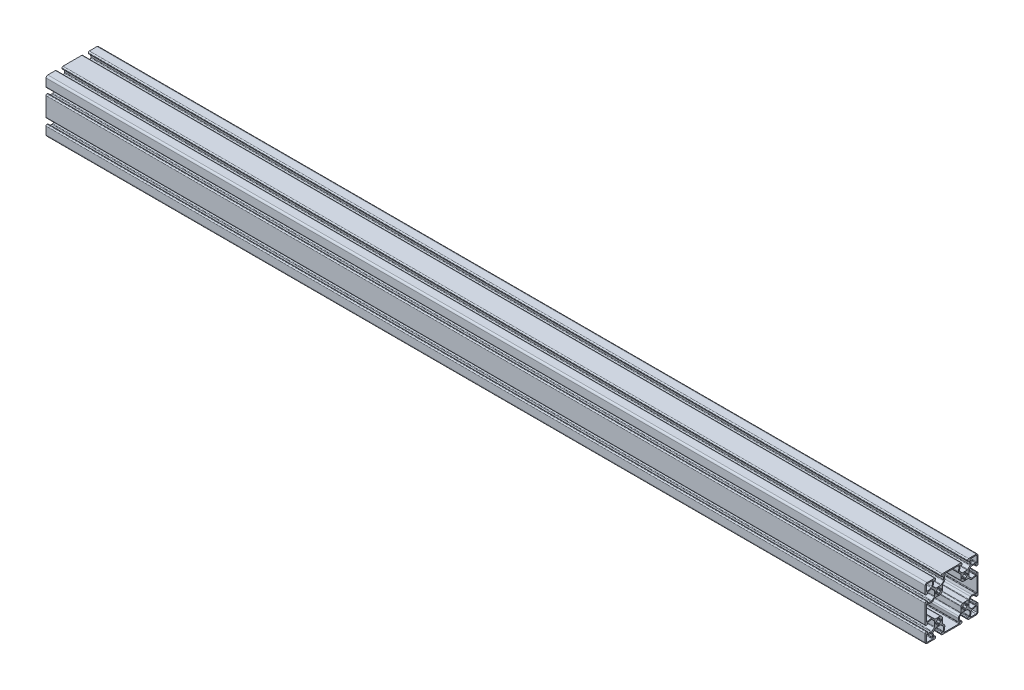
SolidWorks part; units mm, degrees
ref_plane "正面" through (0, 0, 0) normal (0, 0, 1) x (1, 0, 0)
ref_plane "平面" through (0, 0, 0) normal (0, 1, 0) x (1, 0, 0)
ref_plane "右側面" through (0, 0, 0) normal (1, 0, 0) x (0, 0, -1)
sketch "ｽｹｯﾁ1" plane through (0, 0, 0) normal (1, 0, 0) x (0, 0, -1)
  line L0 (-13.8, 23.3503) -> (-13.8, 6.6497)
  line L1 (-15, 25.65) -> (-15, 4.35)
  line L2 (43.8, 23.3503) -> (43.8, 6.6497)
  line L3 (45, 25.65) -> (45, 4.35)
  line L4 (23.3503, -13.8) -> (6.6497, -13.8)
  line L5 (25.65, -15) -> (4.35, -15)
  line L6 (-13.8, -12.8) -> (-13.8, -6.6497)
  line L7 (-15, -13) -> (-15, -4.35)
  line L8 (-6.0721, -8.0894) -> (-5.3672, -12.0868)
  line L9 (-7.2888, -8.0999) -> (-6.549, -12.2952)
  line L10 (6.0721, -8.0894) -> (5.3672, -12.0868)
  line L11 (7.2539, -8.2977) -> (6.549, -12.2952)
  line L12 (-13, -15) -> (-4.35, -15)
  line L13 (-12.8, -13.8) -> (-6.6497, -13.8)
  line L14 (-3.9, -12.5) -> (-4.8748, -12.5)
  line L15 (3.9, -12.5) -> (4.8748, -12.5)
  line L16 (3.15, -13.8) -> (3.15, -13.25)
  line L17 (-3.15, -13.8) -> (-3.15, -13.25)
  line L18 (2.0858, 4.5) -> (-3.8029, 4.5)
  line L19 (-3.3787, -4.7929) -> (-5.7944, -7.2086)
  line L20 (-4.5, -2.6716) -> (-4.5, 2.6716)
  line L21 (-8.0999, -7.2888) -> (-12.2952, -6.549)
  line L22 (-8.0894, -6.0721) -> (-12.0868, -5.3672)
  line L23 (-12.5, -4.8748) -> (-12.5, -3.9)
  line L24 (-13.25, -3.15) -> (-13.8, -3.15)
  line L25 (-4.7929, -3.3787) -> (-7.2086, -5.7944)
  line L26 (-8.2977, 7.2539) -> (-12.2952, 6.549)
  line L27 (-8.0894, 6.0721) -> (-12.0868, 5.3672)
  line L28 (-12.5, 4.8748) -> (-12.5, 3.9)
  line L29 (-13.25, 3.15) -> (-13.8, 3.15)
  line L30 (-4.5101, 4.7929) -> (-6.3601, 6.6429)
  line L31 (-4.7929, 3.3787) -> (-7.2086, 5.7944)
  line L32 (4.5, -3.8029) -> (4.5, 2.0858)
  line L33 (3.5, -0.5) -> (3.5, 0.5)
  line L34 (-3.5, -0.5) -> (-3.5, 0.5)
  line L35 (3.3787, -4.7929) -> (5.7944, -7.2086)
  line L36 (2.6557, -1) -> (3, -1)
  line L37 (1, -2.6557) -> (1, -3)
  line L38 (-2.6557, -1) -> (-3, -1)
  line L39 (-1, -2.6557) -> (-1, -3)
  line L40 (2.6716, -4.5) -> (-2.6716, -4.5)
  line L41 (0.5, -3.5) -> (-0.5, -3.5)
  line L42 (4.7929, -4.5101) -> (6.6429, -6.3601)
  line L43 (4.2071, 2.7929) -> (2.7929, 4.2071)
  line L44 (2.6557, 1) -> (3, 1)
  line L45 (1, 2.6557) -> (1, 3)
  line L46 (-2.6557, 1) -> (-3, 1)
  line L47 (-1, 2.6557) -> (-1, 3)
  line L48 (0.5, 3.5) -> (-0.5, 3.5)
  line L49 (22.7461, -8.2977) -> (23.451, -12.2952)
  line L50 (23.9279, -8.0894) -> (24.6328, -12.0868)
  line L51 (36.0721, -8.0894) -> (35.3672, -12.0868)
  line L52 (37.2888, -8.0999) -> (36.549, -12.2952)
  line L53 (45, -13) -> (45, -4.35)
  line L54 (43.8, -12.8) -> (43.8, -6.6497)
  line L55 (26.85, -13.8) -> (26.85, -13.25)
  line L56 (26.1, -12.5) -> (25.1252, -12.5)
  line L57 (43, -15) -> (34.35, -15)
  line L58 (42.8, -13.8) -> (36.6497, -13.8)
  line L59 (33.15, -13.8) -> (33.15, -13.25)
  line L60 (33.9, -12.5) -> (34.8748, -12.5)
  line L61 (33.8029, 4.5) -> (27.9142, 4.5)
  line L62 (32.6716, -4.5) -> (27.3284, -4.5)
  line L63 (25.5, -3.8029) -> (25.5, 2.0858)
  line L64 (26.5, -0.5) -> (26.5, 0.5)
  line L65 (27.3443, -1) -> (27, -1)
  line L66 (29, -2.6557) -> (29, -3)
  line L67 (25.2071, -4.5101) -> (23.3571, -6.3601)
  line L68 (26.6213, -4.7929) -> (24.2056, -7.2086)
  line L69 (27.2071, 4.2071) -> (25.7929, 2.7929)
  line L70 (27.3443, 1) -> (27, 1)
  line L71 (29, 2.6557) -> (29, 3)
  line L72 (34.5, -2.6716) -> (34.5, 2.6716)
  line L73 (33.5, -0.5) -> (33.5, 0.5)
  line L74 (34.7929, -3.3787) -> (37.2086, -5.7944)
  line L75 (33.3787, -4.7929) -> (35.7944, -7.2086)
  line L76 (31, -2.6557) -> (31, -3)
  line L77 (30.5, -3.5) -> (29.5, -3.5)
  line L78 (32.6557, -1) -> (33, -1)
  line L79 (42.5, -4.8748) -> (42.5, -3.9)
  line L80 (43.25, -3.15) -> (43.8, -3.15)
  line L81 (38.0894, -6.0721) -> (42.0868, -5.3672)
  line L82 (38.0999, -7.2888) -> (42.2952, -6.549)
  line L83 (34.5101, 4.7929) -> (36.3601, 6.6429)
  line L84 (34.7929, 3.3787) -> (37.2086, 5.7944)
  line L85 (31, 2.6557) -> (31, 3)
  line L86 (30.5, 3.5) -> (29.5, 3.5)
  line L87 (32.6557, 1) -> (33, 1)
  line L88 (38.2977, 7.2539) -> (42.2952, 6.549)
  line L89 (43.25, 3.15) -> (43.8, 3.15)
  line L90 (42.5, 4.8748) -> (42.5, 3.9)
  line L91 (38.0894, 6.0721) -> (42.0868, 5.3672)
  line L92 (23.3503, 43.8) -> (6.6497, 43.8)
  line L93 (25.65, 45) -> (4.35, 45)
  line L94 (4.7929, 34.5101) -> (6.6429, 36.3601)
  line L95 (3.3787, 34.7929) -> (5.7944, 37.2086)
  line L96 (-4.7929, 33.3787) -> (-7.2086, 35.7944)
  line L97 (-3.3787, 34.7929) -> (-5.7944, 37.2086)
  line L98 (-15, 43) -> (-15, 34.35)
  line L99 (2.0858, 25.5) -> (-3.8029, 25.5)
  line L100 (-4.5101, 25.2071) -> (-6.3601, 23.3571)
  line L101 (-8.2977, 22.7461) -> (-12.2952, 23.451)
  line L102 (-8.0894, 23.9279) -> (-12.0868, 24.6328)
  line L103 (-13.25, 33.15) -> (-13.8, 33.15)
  line L104 (-12.5, 34.8748) -> (-12.5, 33.9)
  line L105 (-13.25, 26.85) -> (-13.8, 26.85)
  line L106 (-12.5, 25.1252) -> (-12.5, 26.1)
  line L107 (-4.7929, 26.6213) -> (-7.2086, 24.2056)
  line L108 (-4.5, 27.3284) -> (-4.5, 32.6716)
  line L109 (2.7929, 25.7929) -> (4.2071, 27.2071)
  line L110 (0.5, 33.5) -> (-0.5, 33.5)
  line L111 (2.6716, 34.5) -> (-2.6716, 34.5)
  line L112 (-1, 32.6557) -> (-1, 33)
  line L113 (-2.6557, 31) -> (-3, 31)
  line L114 (1, 32.6557) -> (1, 33)
  line L115 (2.6557, 31) -> (3, 31)
  line L116 (0.5, 26.5) -> (-0.5, 26.5)
  line L117 (-1, 27.3443) -> (-1, 27)
  line L118 (-2.6557, 29) -> (-3, 29)
  line L119 (1, 27.3443) -> (1, 27)
  line L120 (2.6557, 29) -> (3, 29)
  line L121 (-3.5, 29.5) -> (-3.5, 30.5)
  line L122 (3.5, 29.5) -> (3.5, 30.5)
  line L123 (4.5, 27.9142) -> (4.5, 33.8029)
  line L124 (-13, 45) -> (-4.35, 45)
  line L125 (-12.8, 43.8) -> (-6.6497, 43.8)
  line L126 (-8.0894, 36.0721) -> (-12.0868, 35.3672)
  line L127 (-8.0999, 37.2888) -> (-13.2132, 36.3872)
  line L128 (-13.8, 42.8) -> (-13.8, 36.8796)
  line L129 (-3.9, 42.5) -> (-4.8748, 42.5)
  line L130 (-7.2888, 38.0999) -> (-6.549, 42.2952)
  line L131 (-6.0721, 38.0894) -> (-5.3672, 42.0868)
  line L132 (3.9, 42.5) -> (4.8748, 42.5)
  line L133 (-3.15, 43.8) -> (-3.15, 43.25)
  line L134 (3.15, 43.8) -> (3.15, 43.25)
  line L135 (7.2539, 38.2977) -> (6.549, 42.2952)
  line L136 (6.0721, 38.0894) -> (5.3672, 42.0868)
  line L137 (33.3787, 34.7929) -> (35.7944, 37.2086)
  line L138 (34.7929, 33.3787) -> (37.2086, 35.7944)
  line L139 (26.6213, 34.7929) -> (24.2056, 37.2086)
  line L140 (25.2071, 34.5101) -> (23.3571, 36.3601)
  line L141 (45, 43) -> (45, 34.35)
  line L142 (33.8029, 25.5) -> (27.9142, 25.5)
  line L143 (32.6716, 34.5) -> (27.3284, 34.5)
  line L144 (27.2071, 25.7929) -> (25.7929, 27.2071)
  line L145 (25.5, 27.9142) -> (25.5, 33.8029)
  line L146 (29, 32.6557) -> (29, 33)
  line L147 (27.3443, 31) -> (27, 31)
  line L148 (29, 27.3443) -> (29, 27)
  line L149 (27.3443, 29) -> (27, 29)
  line L150 (26.5, 29.5) -> (26.5, 30.5)
  line L151 (34.5101, 25.2071) -> (36.3601, 23.3571)
  line L152 (38.2977, 22.7461) -> (42.2952, 23.451)
  line L153 (32.6557, 31) -> (33, 31)
  line L154 (30.5, 33.5) -> (29.5, 33.5)
  line L155 (31, 32.6557) -> (31, 33)
  line L156 (32.6557, 29) -> (33, 29)
  line L157 (30.5, 26.5) -> (29.5, 26.5)
  line L158 (31, 27.3443) -> (31, 27)
  line L159 (34.7929, 26.6213) -> (37.2086, 24.2056)
  line L160 (33.5, 29.5) -> (33.5, 30.5)
  line L161 (34.5, 27.3284) -> (34.5, 32.6716)
  line L162 (42.5, 34.8748) -> (42.5, 33.9)
  line L163 (43.25, 33.15) -> (43.8, 33.15)
  line L164 (38.0894, 23.9279) -> (42.0868, 24.6328)
  line L165 (43.25, 26.85) -> (43.8, 26.85)
  line L166 (42.5, 25.1252) -> (42.5, 26.1)
  line L167 (26.1, 42.5) -> (25.1252, 42.5)
  line L168 (26.85, 43.8) -> (26.85, 43.25)
  line L169 (22.7461, 38.2977) -> (23.451, 42.2952)
  line L170 (23.9279, 38.0894) -> (24.6328, 42.0868)
  line L171 (43, 45) -> (34.35, 45)
  line L172 (42.8, 43.8) -> (36.6497, 43.8)
  line L173 (37.2888, 38.0999) -> (36.549, 42.2952)
  line L174 (33.9, 42.5) -> (34.8748, 42.5)
  line L175 (33.15, 43.8) -> (33.15, 43.25)
  line L176 (36.0721, 38.0894) -> (35.3672, 42.0868)
  line L177 (38.0999, 37.2888) -> (42.2952, 36.549)
  line L178 (38.0894, 36.0721) -> (42.0868, 35.3672)
  line L179 (43.8, 42.8) -> (43.8, 36.6497)
  arc A0 (-4.35, -15) -> (-3.15, -13.8) centre (-4.35, -13.8) ccw
  arc A1 (-3.15, -13.25) -> (-3.9, -12.5) centre (-3.9, -13.25) ccw
  arc A2 (-15, -13) -> (-13, -15) centre (-13, -13) ccw
  arc A3 (-13.8, -12.8) -> (-12.8, -13.8) centre (-12.8, -12.8) ccw
  arc A4 (-5.3672, -12.0868) -> (-4.8748, -12.5) centre (-4.8748, -12) ccw
  arc A5 (-6.6497, -13.8) -> (-6.2463, -13.0045) centre (-6.6497, -13.3) ccw
  arc A6 (-6.549, -12.2952) -> (-6.2463, -13.0045) centre (-4.8748, -12) ccw
  arc A7 (3.15, -13.8) -> (4.35, -15) centre (4.35, -13.8) ccw
  arc A8 (3.9, -12.5) -> (3.15, -13.25) centre (3.9, -13.25) ccw
  arc A9 (4.8748, -12.5) -> (5.3672, -12.0868) centre (4.8748, -12) ccw
  arc A10 (6.2463, -13.0045) -> (6.549, -12.2952) centre (4.8748, -12) ccw
  arc A11 (6.2463, -13.0045) -> (6.6497, -13.8) centre (6.6497, -13.3) ccw
  arc A12 (-12.5, -3.9) -> (-13.25, -3.15) centre (-13.25, -3.9) ccw
  arc A13 (-13.8, -3.15) -> (-15, -4.35) centre (-13.8, -4.35) ccw
  arc A14 (-13.0045, -6.2463) -> (-13.8, -6.6497) centre (-13.3, -6.6497) ccw
  arc A15 (-13.0045, -6.2463) -> (-12.2952, -6.549) centre (-12, -4.8748) ccw
  arc A16 (-12.5, -4.8748) -> (-12.0868, -5.3672) centre (-12, -4.8748) ccw
  arc A17 (-4.7929, -3.3787) -> (-4.5, -2.6716) centre (-5.5, -2.6716) ccw
  arc A18 (-5.7944, -7.2086) -> (-6.0721, -8.0894) centre (-5.0873, -7.9157) ccw
  arc A19 (-7.2888, -8.0999) -> (-8.0999, -7.2888) centre (-8.2736, -8.2736) ccw
  arc A20 (-8.0894, -6.0721) -> (-7.2086, -5.7944) centre (-7.9157, -5.0873) ccw
  arc A21 (-12.2952, 6.549) -> (-13.0045, 6.2463) centre (-12, 4.8748) ccw
  arc A22 (-13.8, 6.6497) -> (-13.0045, 6.2463) centre (-13.3, 6.6497) ccw
  arc A23 (-13.25, 3.15) -> (-12.5, 3.9) centre (-13.25, 3.9) ccw
  arc A24 (-12.0868, 5.3672) -> (-12.5, 4.8748) centre (-12, 4.8748) ccw
  arc A25 (-15, 4.35) -> (-13.8, 3.15) centre (-13.8, 4.35) ccw
  arc A26 (-4.5101, 4.7929) -> (-3.8029, 4.5) centre (-3.8029, 5.5) ccw
  arc A27 (-6.3601, 6.6429) -> (-8.2977, 7.2539) centre (-7.9157, 5.0873) ccw
  arc A28 (-4.5, 2.6716) -> (-4.7929, 3.3787) centre (-5.5, 2.6716) ccw
  arc A29 (-7.2086, 5.7944) -> (-8.0894, 6.0721) centre (-7.9157, 5.0873) ccw
  arc A30 (4.5, -3.8029) -> (4.7929, -4.5101) centre (5.5, -3.8029) ccw
  arc A31 (0.5, -3.5) -> (1, -3) centre (0.5, -3) ccw
  arc A32 (3.3787, -4.7929) -> (2.6716, -4.5) centre (2.6716, -5.5) ccw
  arc A33 (2.6557, -1) -> (2.2203, -1.2541) centre (2.6557, -1.5) ccw
  arc A34 (3, -1) -> (3.5, -0.5) centre (3, -0.5) ccw
  arc A35 (1.2541, -2.2203) -> (1, -2.6557) centre (1.5, -2.6557) ccw
  arc A36 (1.2541, -2.2203) -> (2.2203, -1.2541) centre (0, 0) ccw
  arc A37 (-2.6716, -4.5) -> (-3.3787, -4.7929) centre (-2.6716, -5.5) ccw
  arc A38 (-3.5, -0.5) -> (-3, -1) centre (-3, -0.5) ccw
  arc A39 (-2.2203, -1.2541) -> (-1.2541, -2.2203) centre (0, 0) ccw
  arc A40 (-2.2203, -1.2541) -> (-2.6557, -1) centre (-2.6557, -1.5) ccw
  arc A41 (-1, -3) -> (-0.5, -3.5) centre (-0.5, -3) ccw
  arc A42 (-1, -2.6557) -> (-1.2541, -2.2203) centre (-1.5, -2.6557) ccw
  arc A43 (6.0721, -8.0894) -> (5.7944, -7.2086) centre (5.0873, -7.9157) ccw
  arc A44 (7.2539, -8.2977) -> (6.6429, -6.3601) centre (5.0873, -7.9157) ccw
  arc A45 (4.5, 2.0858) -> (4.2071, 2.7929) centre (3.5, 2.0858) ccw
  arc A46 (2.7929, 4.2071) -> (2.0858, 4.5) centre (2.0858, 3.5) ccw
  arc A47 (1, 2.6557) -> (1.2541, 2.2203) centre (1.5, 2.6557) ccw
  arc A48 (2.2203, 1.2541) -> (1.2541, 2.2203) centre (0, 0) ccw
  arc A49 (2.2203, 1.2541) -> (2.6557, 1) centre (2.6557, 1.5) ccw
  arc A50 (3.5, 0.5) -> (3, 1) centre (3, 0.5) ccw
  arc A51 (1, 3) -> (0.5, 3.5) centre (0.5, 3) ccw
  arc A52 (-1.2541, 2.2203) -> (-2.2203, 1.2541) centre (0, 0) ccw
  arc A53 (-1.2541, 2.2203) -> (-1, 2.6557) centre (-1.5, 2.6557) ccw
  arc A54 (-3, 1) -> (-3.5, 0.5) centre (-3, 0.5) ccw
  arc A55 (-2.6557, 1) -> (-2.2203, 1.2541) centre (-2.6557, 1.5) ccw
  arc A56 (-0.5, 3.5) -> (-1, 3) centre (-0.5, 3) ccw
  arc A57 (23.3503, -13.8) -> (23.7537, -13.0045) centre (23.3503, -13.3) ccw
  arc A58 (23.451, -12.2952) -> (23.7537, -13.0045) centre (25.1252, -12) ccw
  arc A59 (25.65, -15) -> (26.85, -13.8) centre (25.65, -13.8) ccw
  arc A60 (26.85, -13.25) -> (26.1, -12.5) centre (26.1, -13.25) ccw
  arc A61 (24.6328, -12.0868) -> (25.1252, -12.5) centre (25.1252, -12) ccw
  arc A62 (34.8748, -12.5) -> (35.3672, -12.0868) centre (34.8748, -12) ccw
  arc A63 (36.2463, -13.0045) -> (36.549, -12.2952) centre (34.8748, -12) ccw
  arc A64 (36.2463, -13.0045) -> (36.6497, -13.8) centre (36.6497, -13.3) ccw
  arc A65 (33.15, -13.8) -> (34.35, -15) centre (34.35, -13.8) ccw
  arc A66 (33.9, -12.5) -> (33.15, -13.25) centre (33.9, -13.25) ccw
  arc A67 (42.8, -13.8) -> (43.8, -12.8) centre (42.8, -12.8) ccw
  arc A68 (43, -15) -> (45, -13) centre (43, -13) ccw
  arc A69 (29.5, 3.5) -> (29, 3) centre (29.5, 3) ccw
  arc A70 (29, -3) -> (29.5, -3.5) centre (29.5, -3) ccw
  arc A71 (27.3284, -4.5) -> (26.6213, -4.7929) centre (27.3284, -5.5) ccw
  arc A72 (25.2071, -4.5101) -> (25.5, -3.8029) centre (24.5, -3.8029) ccw
  arc A73 (27.7797, -1.2541) -> (27.3443, -1) centre (27.3443, -1.5) ccw
  arc A74 (29, -2.6557) -> (28.7459, -2.2203) centre (28.5, -2.6557) ccw
  arc A75 (27.7797, -1.2541) -> (28.7459, -2.2203) centre (30, 0) ccw
  arc A76 (26.5, -0.5) -> (27, -1) centre (27, -0.5) ccw
  arc A77 (23.3571, -6.3601) -> (22.7461, -8.2977) centre (24.9127, -7.9157) ccw
  arc A78 (24.2056, -7.2086) -> (23.9279, -8.0894) centre (24.9127, -7.9157) ccw
  arc A79 (27.9142, 4.5) -> (27.2071, 4.2071) centre (27.9142, 3.5) ccw
  arc A80 (25.7929, 2.7929) -> (25.5, 2.0858) centre (26.5, 2.0858) ccw
  arc A81 (28.7459, 2.2203) -> (27.7797, 1.2541) centre (30, 0) ccw
  arc A82 (28.7459, 2.2203) -> (29, 2.6557) centre (28.5, 2.6557) ccw
  arc A83 (27.3443, 1) -> (27.7797, 1.2541) centre (27.3443, 1.5) ccw
  arc A84 (27, 1) -> (26.5, 0.5) centre (27, 0.5) ccw
  arc A85 (38.0999, -7.2888) -> (37.2888, -8.0999) centre (38.2736, -8.2736) ccw
  arc A86 (37.2086, -5.7944) -> (38.0894, -6.0721) centre (37.9157, -5.0873) ccw
  arc A87 (34.5, -2.6716) -> (34.7929, -3.3787) centre (35.5, -2.6716) ccw
  arc A88 (36.0721, -8.0894) -> (35.7944, -7.2086) centre (35.0873, -7.9157) ccw
  arc A89 (33, -1) -> (33.5, -0.5) centre (33, -0.5) ccw
  arc A90 (30.5, -3.5) -> (31, -3) centre (30.5, -3) ccw
  arc A91 (31.2541, -2.2203) -> (31, -2.6557) centre (31.5, -2.6557) ccw
  arc A92 (32.6557, -1) -> (32.2203, -1.2541) centre (32.6557, -1.5) ccw
  arc A93 (31.2541, -2.2203) -> (32.2203, -1.2541) centre (30, 0) ccw
  arc A94 (33.3787, -4.7929) -> (32.6716, -4.5) centre (32.6716, -5.5) ccw
  arc A95 (45, -4.35) -> (43.8, -3.15) centre (43.8, -4.35) ccw
  arc A96 (43.25, -3.15) -> (42.5, -3.9) centre (43.25, -3.9) ccw
  arc A97 (43.8, -6.6497) -> (43.0045, -6.2463) centre (43.3, -6.6497) ccw
  arc A98 (42.0868, -5.3672) -> (42.5, -4.8748) centre (42, -4.8748) ccw
  arc A99 (42.2952, -6.549) -> (43.0045, -6.2463) centre (42, -4.8748) ccw
  arc A100 (38.2977, 7.2539) -> (36.3601, 6.6429) centre (37.9157, 5.0873) ccw
  arc A101 (38.0894, 6.0721) -> (37.2086, 5.7944) centre (37.9157, 5.0873) ccw
  arc A102 (33.8029, 4.5) -> (34.5101, 4.7929) centre (33.8029, 5.5) ccw
  arc A103 (33.5, 0.5) -> (33, 1) centre (33, 0.5) ccw
  arc A104 (34.7929, 3.3787) -> (34.5, 2.6716) centre (35.5, 2.6716) ccw
  arc A105 (31, 2.6557) -> (31.2541, 2.2203) centre (31.5, 2.6557) ccw
  arc A106 (32.2203, 1.2541) -> (31.2541, 2.2203) centre (30, 0) ccw
  arc A107 (32.2203, 1.2541) -> (32.6557, 1) centre (32.6557, 1.5) ccw
  arc A108 (31, 3) -> (30.5, 3.5) centre (30.5, 3) ccw
  arc A109 (43.8, 3.15) -> (45, 4.35) centre (43.8, 4.35) ccw
  arc A110 (43.0045, 6.2463) -> (43.8, 6.6497) centre (43.3, 6.6497) ccw
  arc A111 (42.5, 4.8748) -> (42.0868, 5.3672) centre (42, 4.8748) ccw
  arc A112 (42.5, 3.9) -> (43.25, 3.15) centre (43.25, 3.9) ccw
  arc A113 (43.0045, 6.2463) -> (42.2952, 6.549) centre (42, 4.8748) ccw
  arc A114 (-12.0868, 35.3672) -> (-12.5, 34.8748) centre (-12, 34.8748) ccw
  arc A115 (-13.0045, 23.7537) -> (-13.8, 23.3503) centre (-13.3, 23.3503) ccw
  arc A116 (-8.2977, 22.7461) -> (-6.3601, 23.3571) centre (-7.9157, 24.9127) ccw
  arc A117 (-15, 34.35) -> (-13.8, 33.15) centre (-13.8, 34.35) ccw
  arc A118 (-13.25, 33.15) -> (-12.5, 33.9) centre (-13.25, 33.9) ccw
  arc A119 (-12.5, 25.1252) -> (-12.0868, 24.6328) centre (-12, 25.1252) ccw
  arc A120 (-13.0045, 23.7537) -> (-12.2952, 23.451) centre (-12, 25.1252) ccw
  arc A121 (-13.8, 26.85) -> (-15, 25.65) centre (-13.8, 25.65) ccw
  arc A122 (-12.5, 26.1) -> (-13.25, 26.85) centre (-13.25, 26.1) ccw
  arc A123 (-3.8029, 25.5) -> (-4.5101, 25.2071) centre (-3.8029, 24.5) ccw
  arc A124 (-4.5, 32.6716) -> (-4.7929, 33.3787) centre (-5.5, 32.6716) ccw
  arc A125 (-8.0894, 23.9279) -> (-7.2086, 24.2056) centre (-7.9157, 24.9127) ccw
  arc A126 (-4.7929, 26.6213) -> (-4.5, 27.3284) centre (-5.5, 27.3284) ccw
  arc A127 (4.2071, 27.2071) -> (4.5, 27.9142) centre (3.5, 27.9142) ccw
  arc A128 (4.7929, 34.5101) -> (4.5, 33.8029) centre (5.5, 33.8029) ccw
  arc A129 (2.0858, 25.5) -> (2.7929, 25.7929) centre (2.0858, 26.5) ccw
  arc A130 (-0.5, 33.5) -> (-1, 33) centre (-0.5, 33) ccw
  arc A131 (-3.3787, 34.7929) -> (-2.6716, 34.5) centre (-2.6716, 35.5) ccw
  arc A132 (-2.6557, 31) -> (-2.2203, 31.2541) centre (-2.6557, 31.5) ccw
  arc A133 (-3, 31) -> (-3.5, 30.5) centre (-3, 30.5) ccw
  arc A134 (-1.2541, 32.2203) -> (-1, 32.6557) centre (-1.5, 32.6557) ccw
  arc A135 (-1.2541, 32.2203) -> (-2.2203, 31.2541) centre (0, 30) ccw
  arc A136 (1, 33) -> (0.5, 33.5) centre (0.5, 33) ccw
  arc A137 (2.6716, 34.5) -> (3.3787, 34.7929) centre (2.6716, 35.5) ccw
  arc A138 (3.5, 30.5) -> (3, 31) centre (3, 30.5) ccw
  arc A139 (2.2203, 31.2541) -> (2.6557, 31) centre (2.6557, 31.5) ccw
  arc A140 (2.2203, 31.2541) -> (1.2541, 32.2203) centre (0, 30) ccw
  arc A141 (1, 32.6557) -> (1.2541, 32.2203) centre (1.5, 32.6557) ccw
  arc A142 (-1, 27.3443) -> (-1.2541, 27.7797) centre (-1.5, 27.3443) ccw
  arc A143 (-1, 27) -> (-0.5, 26.5) centre (-0.5, 27) ccw
  arc A144 (-2.2203, 28.7459) -> (-2.6557, 29) centre (-2.6557, 28.5) ccw
  arc A145 (-2.2203, 28.7459) -> (-1.2541, 27.7797) centre (0, 30) ccw
  arc A146 (-3.5, 29.5) -> (-3, 29) centre (-3, 29.5) ccw
  arc A147 (1.2541, 27.7797) -> (2.2203, 28.7459) centre (0, 30) ccw
  arc A148 (1.2541, 27.7797) -> (1, 27.3443) centre (1.5, 27.3443) ccw
  arc A149 (3, 29) -> (3.5, 29.5) centre (3, 29.5) ccw
  arc A150 (2.6557, 29) -> (2.2203, 28.7459) centre (2.6557, 28.5) ccw
  arc A151 (0.5, 26.5) -> (1, 27) centre (0.5, 27) ccw
  arc A152 (-3.9, 42.5) -> (-3.15, 43.25) centre (-3.9, 43.25) ccw
  arc A153 (-3.15, 43.8) -> (-4.35, 45) centre (-4.35, 43.8) ccw
  arc A154 (-13, 45) -> (-15, 43) centre (-13, 43) ccw
  arc A155 (-12.8, 43.8) -> (-13.8, 42.8) centre (-12.8, 42.8) ccw
  arc A156 (-13.8, 36.8796) -> (-13.2132, 36.3872) centre (-13.3, 36.8796) ccw
  arc A157 (-6.2463, 43.0045) -> (-6.549, 42.2952) centre (-4.8748, 42) ccw
  arc A158 (-4.8748, 42.5) -> (-5.3672, 42.0868) centre (-4.8748, 42) ccw
  arc A159 (-6.2463, 43.0045) -> (-6.6497, 43.8) centre (-6.6497, 43.3) ccw
  arc A160 (-8.0999, 37.2888) -> (-7.2888, 38.0999) centre (-8.2736, 38.2736) ccw
  arc A161 (-7.2086, 35.7944) -> (-8.0894, 36.0721) centre (-7.9157, 35.0873) ccw
  arc A162 (-6.0721, 38.0894) -> (-5.7944, 37.2086) centre (-5.0873, 37.9157) ccw
  arc A163 (3.15, 43.25) -> (3.9, 42.5) centre (3.9, 43.25) ccw
  arc A164 (4.35, 45) -> (3.15, 43.8) centre (4.35, 43.8) ccw
  arc A165 (6.549, 42.2952) -> (6.2463, 43.0045) centre (4.8748, 42) ccw
  arc A166 (5.3672, 42.0868) -> (4.8748, 42.5) centre (4.8748, 42) ccw
  arc A167 (6.6497, 43.8) -> (6.2463, 43.0045) centre (6.6497, 43.3) ccw
  arc A168 (5.7944, 37.2086) -> (6.0721, 38.0894) centre (5.0873, 37.9157) ccw
  arc A169 (6.6429, 36.3601) -> (7.2539, 38.2977) centre (5.0873, 37.9157) ccw
  arc A170 (42.5, 34.8748) -> (42.0868, 35.3672) centre (42, 34.8748) ccw
  arc A171 (29, 27) -> (29.5, 26.5) centre (29.5, 27) ccw
  arc A172 (29.5, 33.5) -> (29, 33) centre (29.5, 33) ccw
  arc A173 (25.5, 27.9142) -> (25.7929, 27.2071) centre (26.5, 27.9142) ccw
  arc A174 (27.2071, 25.7929) -> (27.9142, 25.5) centre (27.9142, 26.5) ccw
  arc A175 (25.5, 33.8029) -> (25.2071, 34.5101) centre (24.5, 33.8029) ccw
  arc A176 (26.6213, 34.7929) -> (27.3284, 34.5) centre (27.3284, 35.5) ccw
  arc A177 (27, 31) -> (26.5, 30.5) centre (27, 30.5) ccw
  arc A178 (27.3443, 31) -> (27.7797, 31.2541) centre (27.3443, 31.5) ccw
  arc A179 (28.7459, 32.2203) -> (29, 32.6557) centre (28.5, 32.6557) ccw
  arc A180 (28.7459, 32.2203) -> (27.7797, 31.2541) centre (30, 30) ccw
  arc A181 (26.5, 29.5) -> (27, 29) centre (27, 29.5) ccw
  arc A182 (27.7797, 28.7459) -> (28.7459, 27.7797) centre (30, 30) ccw
  arc A183 (29, 27.3443) -> (28.7459, 27.7797) centre (28.5, 27.3443) ccw
  arc A184 (27.7797, 28.7459) -> (27.3443, 29) centre (27.3443, 28.5) ccw
  arc A185 (43.8, 23.3503) -> (43.0045, 23.7537) centre (43.3, 23.3503) ccw
  arc A186 (36.3601, 23.3571) -> (38.2977, 22.7461) centre (37.9157, 24.9127) ccw
  arc A187 (37.2086, 24.2056) -> (38.0894, 23.9279) centre (37.9157, 24.9127) ccw
  arc A188 (34.5101, 25.2071) -> (33.8029, 25.5) centre (33.8029, 24.5) ccw
  arc A189 (32.6716, 34.5) -> (33.3787, 34.7929) centre (32.6716, 35.5) ccw
  arc A190 (31, 33) -> (30.5, 33.5) centre (30.5, 33) ccw
  arc A191 (32.2203, 31.2541) -> (32.6557, 31) centre (32.6557, 31.5) ccw
  arc A192 (32.2203, 31.2541) -> (31.2541, 32.2203) centre (30, 30) ccw
  arc A193 (31, 32.6557) -> (31.2541, 32.2203) centre (31.5, 32.6557) ccw
  arc A194 (34.7929, 33.3787) -> (34.5, 32.6716) centre (35.5, 32.6716) ccw
  arc A195 (33.5, 30.5) -> (33, 31) centre (33, 30.5) ccw
  arc A196 (31.2541, 27.7797) -> (32.2203, 28.7459) centre (30, 30) ccw
  arc A197 (32.6557, 29) -> (32.2203, 28.7459) centre (32.6557, 28.5) ccw
  arc A198 (31.2541, 27.7797) -> (31, 27.3443) centre (31.5, 27.3443) ccw
  arc A199 (30.5, 26.5) -> (31, 27) centre (30.5, 27) ccw
  arc A200 (33, 29) -> (33.5, 29.5) centre (33, 29.5) ccw
  arc A201 (34.5, 27.3284) -> (34.7929, 26.6213) centre (35.5, 27.3284) ccw
  arc A202 (42.5, 33.9) -> (43.25, 33.15) centre (43.25, 33.9) ccw
  arc A203 (43.8, 33.15) -> (45, 34.35) centre (43.8, 34.35) ccw
  arc A204 (42.2952, 23.451) -> (43.0045, 23.7537) centre (42, 25.1252) ccw
  arc A205 (42.0868, 24.6328) -> (42.5, 25.1252) centre (42, 25.1252) ccw
  arc A206 (43.25, 26.85) -> (42.5, 26.1) centre (43.25, 26.1) ccw
  arc A207 (45, 25.65) -> (43.8, 26.85) centre (43.8, 25.65) ccw
  arc A208 (25.1252, 42.5) -> (24.6328, 42.0868) centre (25.1252, 42) ccw
  arc A209 (23.7537, 43.0045) -> (23.451, 42.2952) centre (25.1252, 42) ccw
  arc A210 (23.7537, 43.0045) -> (23.3503, 43.8) centre (23.3503, 43.3) ccw
  arc A211 (26.1, 42.5) -> (26.85, 43.25) centre (26.1, 43.25) ccw
  arc A212 (26.85, 43.8) -> (25.65, 45) centre (25.65, 43.8) ccw
  arc A213 (23.9279, 38.0894) -> (24.2056, 37.2086) centre (24.9127, 37.9157) ccw
  arc A214 (22.7461, 38.2977) -> (23.3571, 36.3601) centre (24.9127, 37.9157) ccw
  arc A215 (37.2888, 38.0999) -> (38.0999, 37.2888) centre (38.2736, 38.2736) ccw
  arc A216 (38.0894, 36.0721) -> (37.2086, 35.7944) centre (37.9157, 35.0873) ccw
  arc A217 (33.15, 43.25) -> (33.9, 42.5) centre (33.9, 43.25) ccw
  arc A218 (34.35, 45) -> (33.15, 43.8) centre (34.35, 43.8) ccw
  arc A219 (36.549, 42.2952) -> (36.2463, 43.0045) centre (34.8748, 42) ccw
  arc A220 (35.3672, 42.0868) -> (34.8748, 42.5) centre (34.8748, 42) ccw
  arc A221 (36.6497, 43.8) -> (36.2463, 43.0045) centre (36.6497, 43.3) ccw
  arc A222 (35.7944, 37.2086) -> (36.0721, 38.0894) centre (35.0873, 37.9157) ccw
  arc A223 (43.8, 42.8) -> (42.8, 43.8) centre (42.8, 42.8) ccw
  arc A224 (45, 43) -> (43, 45) centre (43, 43) ccw
  arc A225 (43.0045, 36.2463) -> (42.2952, 36.549) centre (42, 34.8748) ccw
  arc A226 (43.0045, 36.2463) -> (43.8, 36.6497) centre (43.3, 36.6497) ccw
extrude "ﾎﾞｽ - 押し出し1" add sketch "ｽｹｯﾁ1" along normal blind 1000
